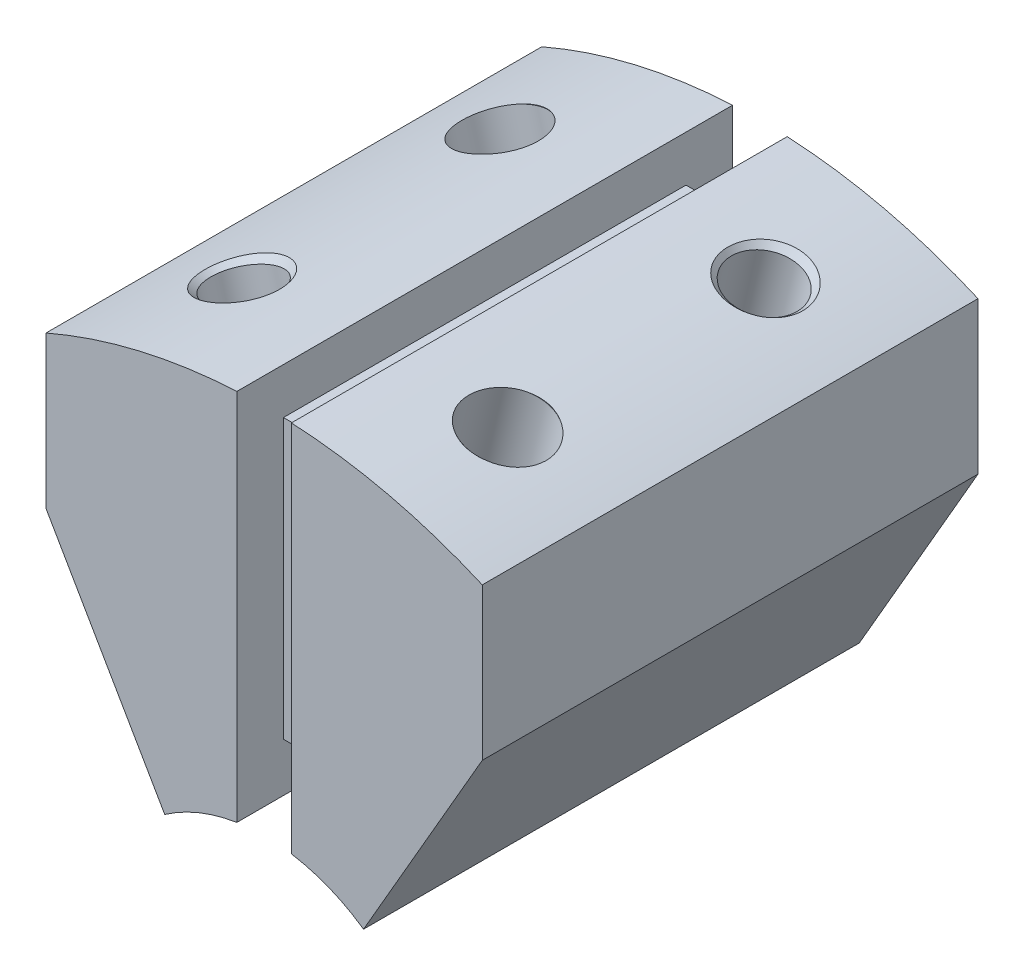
SolidWorks part; units mm, degrees
ref_plane "前视基准面" through (0, 0, 0) normal (0, 0, 1) x (1, 0, 0)
ref_plane "上视基准面" through (0, 0, 0) normal (0, 1, 0) x (1, 0, 0)
ref_plane "右视基准面" through (0, 0, 0) normal (1, 0, 0) x (0, 0, -1)
other "Configuration Table"
sketch "草图1" plane through (0, 0, 0) normal (0, 0, 1) x (1, 0, 0)
  line L0 (0, 55) -> (0, -55) construction
  line L1 (-22, 50.4083) -> (-22, 35.0814)
  line L2 (-22, 35.0814) -> (-10.0266, 14.3429)
  line L3 (0, 0) -> (-14.235, 53.1259) construction
  line L4 (22, 50.4083) -> (22, 35.0814)
  line L5 (0, 0) -> (14.235, 53.1259) construction
  line L6 (22, 35.0814) -> (10.0266, 14.3429)
  line L7 (-2.75, 54.9312) -> (-2.75, 50.3)
  line L8 (-2.75, 50.3) -> (2.75, 50.3)
  line L9 (-2.75, 17.2826) -> (-2.75, 22.2)
  line L10 (-2.75, 22.2) -> (2.75, 22.2)
  line L11 (2.75, 54.9312) -> (2.75, 50.3)
  line L12 (2.75, 17.2826) -> (2.75, 22.2)
  arc A0 (10.0266, 14.3429) -> (2.75, 17.2826) centre (0, 0) ccw construction
  arc A1 (22, 50.4083) -> (2.75, 54.9312) centre (0, 0) ccw
  arc A2 (10.0266, 14.3429) -> (2.75, 17.2826) centre (0, 0) ccw
  arc A3 (-2.75, 54.9312) -> (-22, 50.4083) centre (0, 0) ccw
  arc A4 (-2.75, 17.2826) -> (-10.0266, 14.3429) centre (0, 0) ccw construction
  arc A5 (-2.75, 17.2826) -> (-10.0266, 14.3429) centre (0, 0) ccw
  point P21 (0, 50.3)
  point P22 (0, 22.2)
  dimension "D1" = 35
  dimension "D2" = 110
  dimension "D3" = 22
  dimension "D7" = 2.75
  dimension "D4" = 30
  dimension "D5" = 15.3269
  dimension "D6" = 15
  dimension "D8" = 4.7
extrude "凸台-拉伸2" add sketch "草图1" along normal mid plane 50
ref_plane "基准面1" through (0, 0, 13) normal (0, 0, 1) x (1, 0, 0)
ref_plane "基准面2" through (0, 0, -13) normal (0, 0, 1) x (1, 0, 0)
sketch "草图3" plane through (0, 0, 25) normal (0, 0, 1) x (1, 0, 0)
  line L0 (0, 0) -> (0, 37.4464) construction
  line L1 (0, 0) -> (-12.5012, 46.655) construction
  dimension "D1" = 15
ref_plane "基准面3" through (0, 0, 0) normal (0.9659, 0.2588, 0) x (-0.2588, 0.9659, 0)
ref_plane "基准面4" through (0, 55, 0) normal (0, 1, 0) x (1, 0, 0)
sketch "草图7" plane through (0, 50.3, 0) normal (0, 1, 0) x (1, 0, 0)
  line L0 (2.75, -25) -> (2.75, 25) construction
  line L1 (-2.75, 25) -> (2.75, 25)
  line L2 (-2.75, 25) -> (-2.75, 20.3)
  line L3 (-2.75, 20.3) -> (2.75, 20.3)
  line L4 (2.75, 25) -> (2.75, 20.3)
  line L5 (-2.75, -25) -> (-2.75, 25) construction
  line L6 (2.75, -25) -> (-2.75, -25)
  line L7 (2.75, -25) -> (2.75, -20.3)
  line L8 (2.75, -20.3) -> (-2.75, -20.3)
  line L9 (-2.75, -25) -> (-2.75, -20.3)
  dimension "D1" = 4.7
  dimension "D2" = 4.7
extrude "切除-拉伸1" cut sketch "草图7" against normal through all
sketch "草图8" plane through (0, 0, 13) normal (0, 0, 1) x (1, 0, 0)
  line L0 (0, 0) -> (-14.235, 53.1259) construction
  line L1 (3.4378, -12.8301) -> (-3.4378, 12.8301) construction
  arc A0 (-2.75, 54.9312) -> (-22, 50.4083) centre (0, 0) ccw construction
sketch "草图9" plane through (0, 0, 13) normal (0, 0, 1) x (1, 0, 0)
  line L0 (0, 0) -> (12.5799, 53.542) construction
  arc A0 (22, 50.4083) -> (2.75, 54.9312) centre (0, 0) ccw construction
sketch "草图10" plane through (0, 0, -13) normal (0, 0, 1) x (1, 0, 0)
  line L0 (0, 0) -> (-14.235, 53.1259) construction
  line L1 (0, 0) -> (12.5799, 53.542) construction
hole_wizard "Ø8.0mm 暗销孔3" positions "3D草图11" profile "草图23" hole size "Ø8.0" standard "GB"
sketch3d "3D草图11"
  point P0 (-14.235, 53.1259, -13)
sketch "草图23" plane through (-14.235, 53.1259, -13) normal (0, 0, 1) x (-0.9659, -0.2588, 0)
  line L0 (0, 0) -> (0, 17.4034)
  line L1 (0, 17.4034) -> (4, 15)
  line L2 (4, 15) -> (4, 0.025)
  line L3 (4, 0.025) -> (4.025, 0)
  line L5 (4.025, 0) -> (0, 0)
  line L6 (-4, 0.025) -> (-4.025, 0) construction
  line L10 (0, 17.4034) -> (-4, 15) construction
  line L11 (0, -6.35) -> (0, 107.95) construction
  dimension "孔直径" = 8
  dimension "孔深度" = 15
  dimension "近端锥形沉头孔直径" = 8.05
  dimension "近端锥形沉头孔角度" = 90
  dimension "导头角度" = 118
hole_wizard "Ø8.0mm 暗销孔4" positions "3D草图12" profile "草图24" hole size "Ø8.0" standard "GB"
sketch3d "3D草图12"
  point P0 (12.5799, 53.542, 13)
sketch "草图24" plane through (12.5799, 53.542, 13) normal (0, 0, 1) x (-0.9735, 0.2287, 0)
  line L0 (0, 0) -> (0, 17.4034)
  line L1 (0, 17.4034) -> (4, 15)
  line L2 (4, 15) -> (4, 0.025)
  line L3 (4, 0.025) -> (4.025, 0)
  line L5 (4.025, 0) -> (0, 0)
  line L6 (-4, 0.025) -> (-4.025, 0) construction
  line L10 (0, 17.4034) -> (-4, 15) construction
  line L11 (0, -6.35) -> (0, 107.95) construction
  dimension "孔直径" = 8
  dimension "孔深度" = 15
  dimension "近端锥形沉头孔直径" = 8.05
  dimension "近端锥形沉头孔角度" = 90
  dimension "导头角度" = 118
hole_wizard "M8 螺纹孔1" positions "3D草图13" profile "草图25" tap size "M8" standard "GB"
sketch3d "3D草图13"
  point P0 (-14.235, 53.1259, 13)
sketch "草图25" plane through (-14.235, 53.1259, 13) normal (0, 0, 1) x (-0.9659, -0.2588, 0)
  line L0 (0, 0) -> (0, 20.0429)
  line L1 (0, 20.0429) -> (3.4, 18)
  line L2 (3.4, 18) -> (3.4, 0.625)
  line L3 (3.4, 0.625) -> (4.025, 0)
  line L5 (4.025, 0) -> (0, 0)
  line L6 (-3.4, 0.625) -> (-4.025, 0) construction
  line L10 (0, 20.0429) -> (-3.4, 18) construction
  line L11 (0, -6.35) -> (0, 107.95) construction
  dimension "螺纹孔钻头直径" = 6.8
  dimension "螺纹孔钻头深度" = 18
  dimension "近端锥形沉头孔直径" = 8.05
  dimension "近端锥形沉头孔角度" = 90
  dimension "导头角度" = 118
hole_wizard "M8 螺纹孔2" positions "3D草图14" profile "草图26" tap size "M8" standard "GB"
sketch3d "3D草图14"
  line L0 (0, 0, -13) -> (12.5799, 53.542, -13) construction
  point P0 (12.5799, 53.542, -13)
sketch "草图26" plane through (12.5799, 53.542, -13) normal (0, 0, 1) x (-0.9735, 0.2287, 0)
  line L0 (0, 0) -> (0, 20.0429)
  line L1 (0, 20.0429) -> (3.4, 18)
  line L2 (3.4, 18) -> (3.4, 0.625)
  line L3 (3.4, 0.625) -> (4.025, 0)
  line L5 (4.025, 0) -> (0, 0)
  line L6 (-3.4, 0.625) -> (-4.025, 0) construction
  line L10 (0, 20.0429) -> (-3.4, 18) construction
  line L11 (0, -6.35) -> (0, 107.95) construction
  dimension "螺纹孔钻头直径" = 6.8
  dimension "螺纹孔钻头深度" = 18
  dimension "近端锥形沉头孔直径" = 8.05
  dimension "近端锥形沉头孔角度" = 90
  dimension "导头角度" = 118
